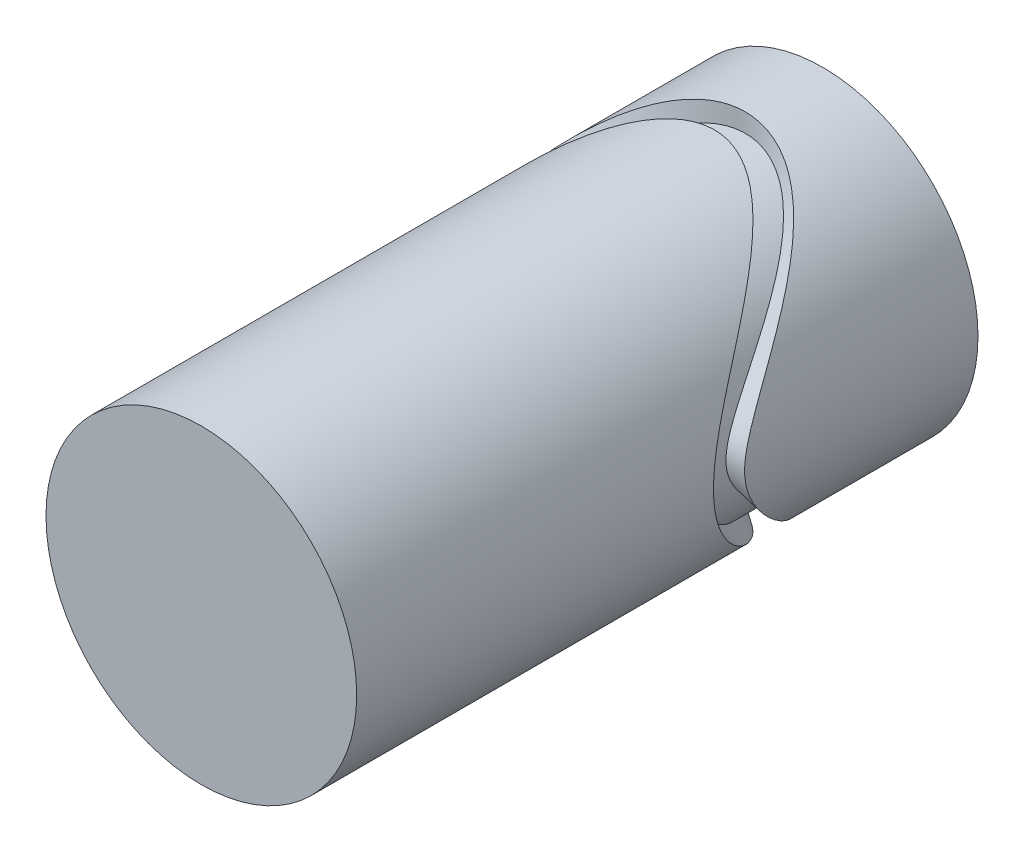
SolidWorks part; units mm, degrees
ref_plane "Ebene vorne" through (0, 0, 0) normal (0, 0, 1) x (1, 0, 0)
ref_plane "Ebene oben" through (0, 0, 0) normal (0, 1, 0) x (1, 0, 0)
ref_plane "Ebene rechts" through (0, 0, 0) normal (1, 0, 0) x (0, 0, -1)
sketch "Skizze1" plane through (0, 0, 0) normal (0, 0, 1) x (1, 0, 0)
  circle A0 centre (0, 0) radius 25
extrude "Linear austragen1" add sketch "Skizze1" along normal blind 100
ref_plane "Ebene1" through (0, 50, 0) normal (0, 1, 0) x (-1, 0, 0)
sketch "Skizze2" plane through (0, 50, 0) normal (0, 1, 0) x (1, 0, 0)
  line L0 (-19.635, -30) -> (-23.1798, -26.4738)
  line L6 (137.4447, -30) -> (133.8998, -26.4738)
  line L9 (-19.635, -30) -> (-19.635, -37.0899) construction
  line L10 (-24.635, -27.9367) -> (-24.635, -37.0899) construction
  line L11 (142.4447, -17.8836) -> (142.4447, -41.8139) construction
  line L12 (137.4447, -30) -> (137.4447, -41.8139) construction
  spline S0 degree 4 number of poles 155 (-34.5575, -41.6839) -> (152.3672, -18.3161) construction
  spline S1 degree 4 number of poles 105 (-19.635, -30) -> (137.4447, -30)
  spline S2 degree 1 poles (-24.635, -27.9367) (142.4447, -17.8836) knots 0 0 1 1 construction
  spline S3 degree 3 number of poles 83 (-23.1798, -26.4738) -> (133.8998, -26.4738)
  dimension "D2" = 5
wrap "Umwickeln1" sketch "Skizze2" source sketch "Skizze2" thickness 3 parameters "D1"=3
